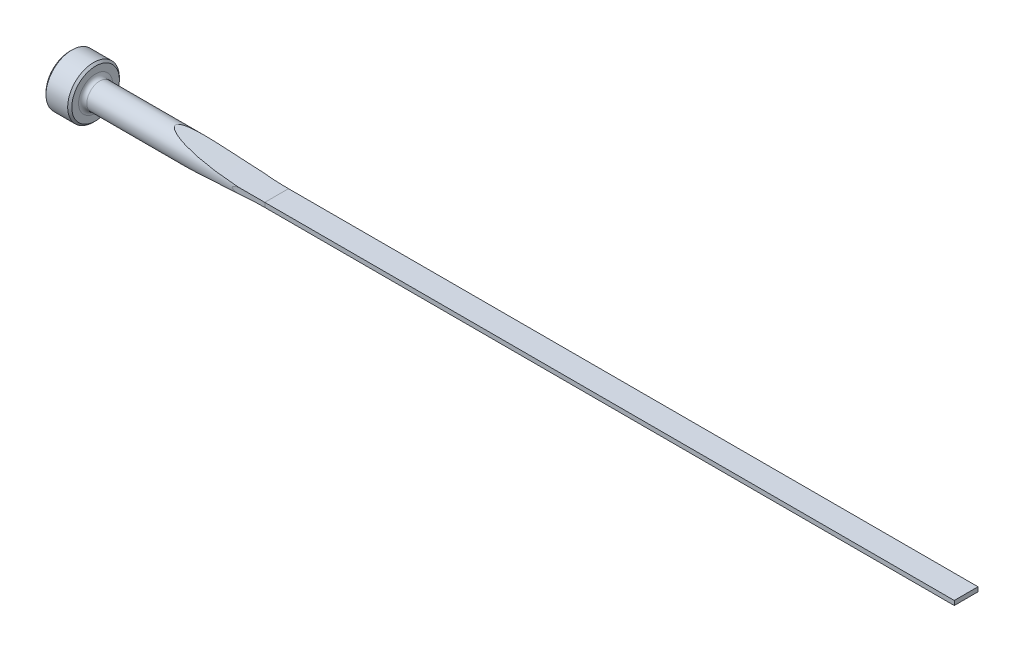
SolidWorks part; units mm, degrees
ref_plane "Front Plane" through (0, 0, 0) normal (0, 0, 1) x (1, 0, 0)
ref_plane "Top Plane" through (0, 0, 0) normal (0, 1, 0) x (1, 0, 0)
ref_plane "Right Plane" through (0, 0, 0) normal (1, 0, 0) x (0, 0, -1)
sketch "Sketch1" plane through (0, 0, 0) normal (0, 0, 1) x (1, 0, 0)
  line L0 (0, 0) -> (167.7268, 0) construction
  line L1 (0, 0) -> (0, 4.7625)
  line L2 (0, 4.7625) -> (4.7498, 4.7625)
  line L3 (4.7498, 4.7625) -> (4.7498, 2.3749)
  line L4 (4.7498, 2.3749) -> (165.1, 2.3749)
  line L5 (165.1, 2.3749) -> (165.1, 0)
  line L6 (165.1, 0) -> (0, 0)
  dimension "D1" = 165.1
  dimension "D2" = 9.525
  dimension "D3" = 4.7498
  dimension "D4" = 4.7498
revolve "Revolve1" add sketch "Sketch1" angle 360 about L0
sketch "Sketch2" plane through (0, 0, 0) normal (0, 0, 1) x (1, 0, 0)
  line L0 (165.1, 2.3749) -> (165.1, 0.4064)
  line L1 (165.1, -2.3749) -> (165.1, 2.3749) construction
  line L2 (165.1, 0.4064) -> (38.1, 0.4064)
  line L3 (165.1, 2.3749) -> (4.7498, 2.3749) construction
  line L4 (19.4956, 2.3749) -> (165.1, 2.3749)
  line L5 (166.0833, 0) -> (153.1705, 0) construction
  arc A0 (38.1, 0.4064) -> (19.4956, 2.3749) centre (38.1, 89.3064) cw
  dimension "D1" = 88.9
  dimension "D3" = 127
  dimension "D2" = 0.8128
  dimension "D4" = 18.6044
extrude "Cut-Extrude1" cut sketch "Sketch2" against normal through all both and the other way through all
mirror "Mirror1" about plane through (0, 0, 0) normal (0, 1, 0) of "Cut-Extrude1"
sketch "Sketch3" plane through (0, 0, 0) normal (0, 1, 0) x (1, 0, 0)
  line L0 (165.1, 2.3749) -> (165.1, 2.1844)
  line L1 (165.1, 2.3399) -> (165.1, -2.3399) construction
  line L2 (165.1, 2.1844) -> (38.1, 2.1844)
  line L3 (165.1, 2.3749) -> (4.7498, 2.3749) construction
  line L4 (32.2832, 2.3749) -> (165.1, 2.3749)
  line L5 (163.4716, 0) -> (166.2513, 0) construction
  line L6 (38.1, 2.3399) -> (38.1, -2.3399) construction
  arc A0 (38.1, 2.1844) -> (32.2832, 2.3749) centre (38.1, 91.0844) cw
  dimension "D2" = 88.9
  dimension "D1" = 4.3688
extrude "Cut-Extrude2" cut sketch "Sketch3" against normal through all both and the other way through all
mirror "Mirror2" about plane through (0, 0, 0) normal (0, 0, 1) of "Cut-Extrude2"
fillet "Fillet1" radius 0.762 1 edges at (4.7498, 0, 2.3749)
chamfer "Chamfer1" distance 0.381 angle 45 2 edges at (0, 0, 4.7625) (4.7498, 0, 4.7625)
